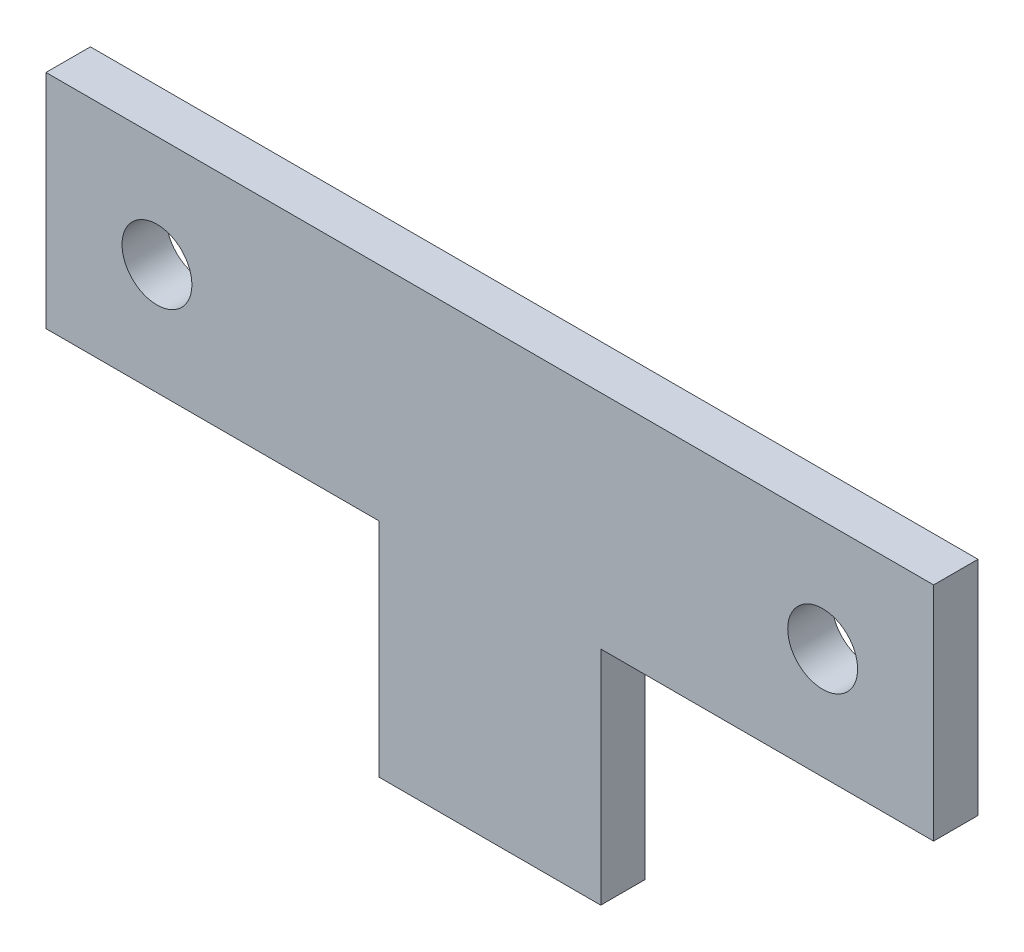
SolidWorks part; units mm, degrees
ref_plane "Front Plane" through (0, 0, 0) normal (0, 0, 1) x (1, 0, 0)
ref_plane "Top Plane" through (0, 0, 0) normal (0, 1, 0) x (1, 0, 0)
ref_plane "Right Plane" through (0, 0, 0) normal (1, 0, 0) x (0, 0, -1)
sketch "Sketch1" plane through (0, 0, 0) normal (0, 0, 1) x (1, 0, 0)
  line L1 (-50.8, -12.7) -> (50.8, -12.7)
  line L2 (-50.8, -12.7) -> (-50.8, 12.7)
  line L3 (-50.8, 12.7) -> (50.8, 12.7)
  line L4 (50.8, -12.7) -> (50.8, 12.7)
  line L5 (-50.8, -12.7) -> (50.8, 12.7) construction
  line L6 (-50.8, 12.7) -> (50.8, -12.7) construction
  point P0 (0, 0)
  dimension "D1" = 25.4
  dimension "D2" = 101.6
extrude "Boss-Extrude1" add sketch "Sketch1" along normal blind 5.08
sketch "Sketch2" plane through (0, 0, 5.08) normal (0, 0, 1) x (1, 0, 0)
  line L0 (-50.8, 0) -> (50.8, 0) construction
  line L1 (-50.8, 12.7) -> (-50.8, -12.7) construction
  line L2 (50.8, -12.7) -> (50.8, 12.7) construction
  line L3 (-38.1, 12.7) -> (-38.1, -12.7) construction
  line L4 (50.8, 12.7) -> (-50.8, 12.7) construction
  line L5 (-50.8, -12.7) -> (50.8, -12.7) construction
  circle A0 centre (-38.1, 0) radius 4
  dimension "D1" = 8
  dimension "D2" = 38.1
extrude "Cut-Extrude1" cut sketch "Sketch2" against normal through all
mirror "Mirror1" about plane through (0, 0, 0) normal (1, 0, 0) of "Cut-Extrude1"
sketch "Sketch3" plane through (0, 0, 5.08) normal (0, 0, 1) x (1, 0, 0)
  line L0 (0, 12.7) -> (0, -38.1) construction
  line L1 (-12.7, -38.1) -> (12.7, -38.1)
  line L2 (-12.7, -38.1) -> (-12.7, 12.7)
  line L3 (-12.7, 12.7) -> (12.7, 12.7)
  line L4 (12.7, -38.1) -> (12.7, 12.7)
  line L5 (50.8, 12.7) -> (-50.8, 12.7) construction
  point P0 (0, 0)
  dimension "D1" = 25.4
  dimension "D2" = 50.8
extrude "Boss-Extrude2" add sketch "Sketch3" against normal blind 5.08 contours L2 L1 L4 L3
